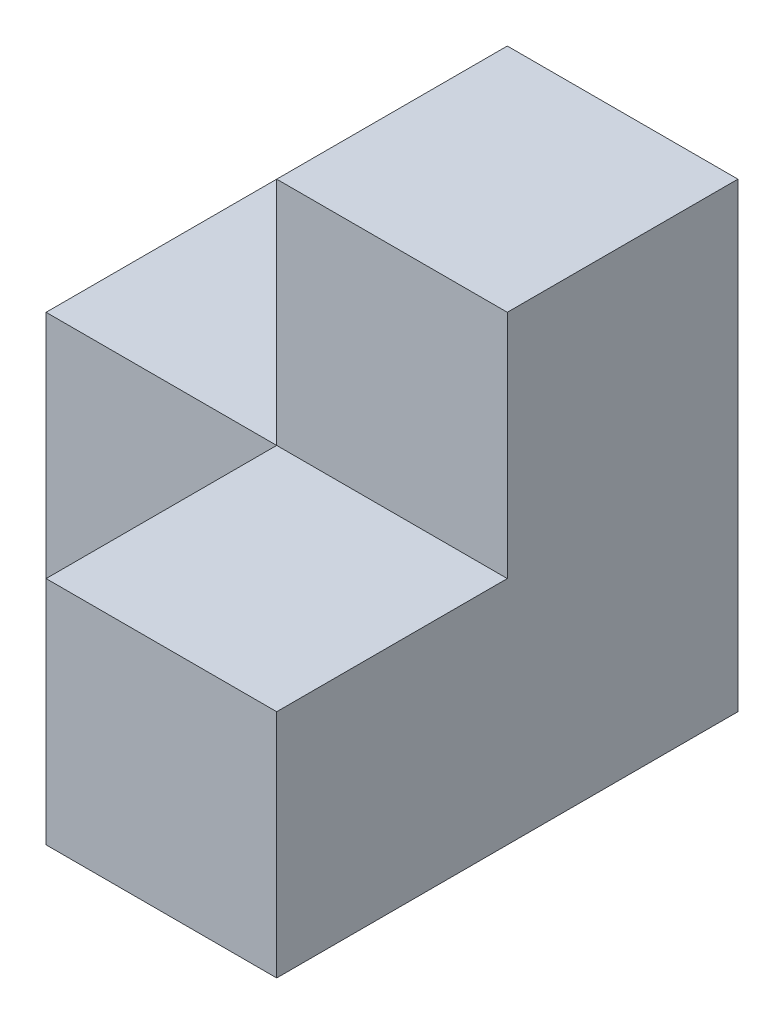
SolidWorks part; units mm, degrees
ref_plane "Front Plane" through (0, 0, 0) normal (0, 0, 1) x (1, 0, 0)
ref_plane "Top Plane" through (0, 0, 0) normal (0, 1, 0) x (1, 0, 0)
ref_plane "Right Plane" through (0, 0, 0) normal (1, 0, 0) x (0, 0, -1)
sketch "Sketch1" plane through (0, 0, 0) normal (0, 1, 0) x (1, 0, 0)
  line L0 (0, 0) -> (-152.4, 0)
  line L1 (-152.4, 0) -> (-152.4, -76.2)
  line L2 (-152.4, -76.2) -> (-76.2, -76.2)
  line L3 (-76.2, -76.2) -> (-76.2, -152.4)
  line L4 (-76.2, -152.4) -> (0, -152.4)
  line L5 (0, -152.4) -> (0, 0)
  line L6 (-76.2, -76.2) -> (-76.2, 0) construction
  line L7 (-76.2, -76.2) -> (0, -76.2) construction
  dimension "D1" = 152.4
extrude "Boss-Extrude1" add sketch "Sketch1" along normal blind 76.2
sketch "Sketch2" plane through (0, 76.2, 0) normal (0, 1, 0) x (1, 0, 0)
  line L1 (0, 0) -> (-76.2, 0)
  line L2 (0, 0) -> (0, -76.2)
  line L3 (0, -76.2) -> (-76.2, -76.2)
  line L4 (-76.2, 0) -> (-76.2, -76.2)
extrude "Boss-Extrude2" add sketch "Sketch2" along normal blind 76.2
